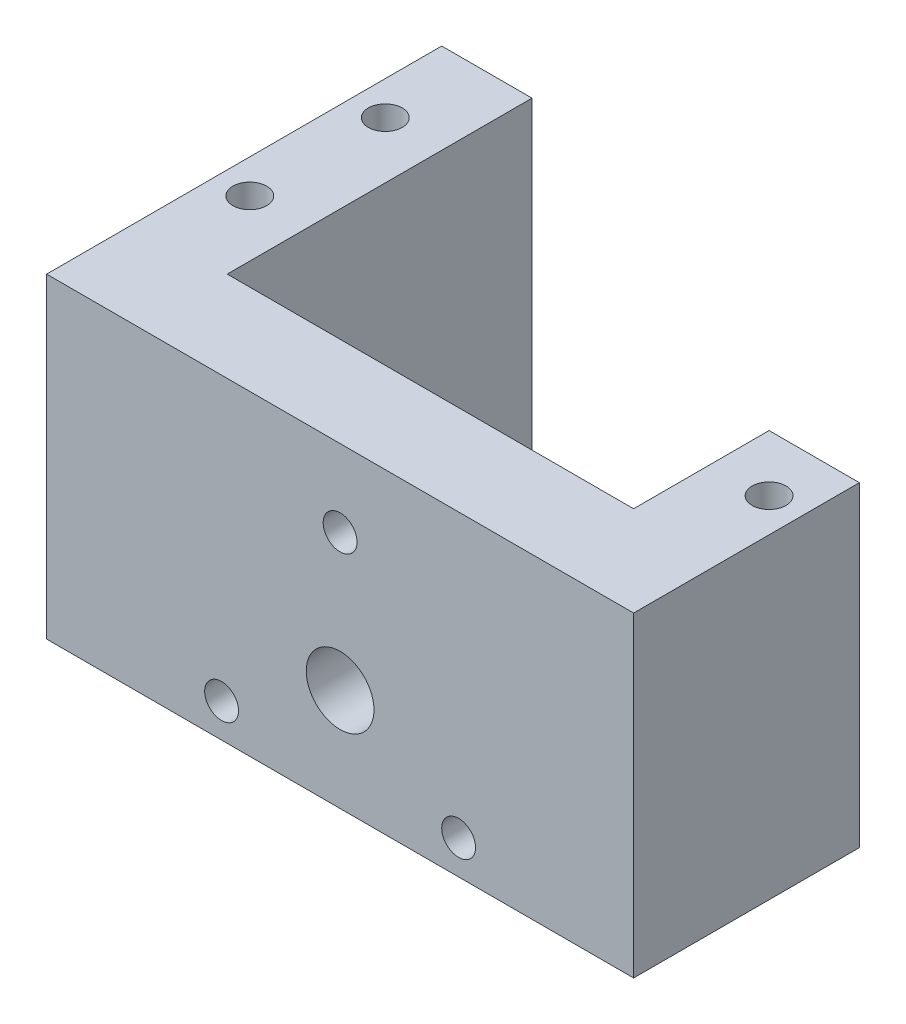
SolidWorks part; units mm, degrees
ref_plane "前视基准面" through (0, 0, 0) normal (0, 0, 1) x (1, 0, 0)
ref_plane "上视基准面" through (0, 0, 0) normal (0, 1, 0) x (1, 0, 0)
ref_plane "右视基准面" through (0, 0, 0) normal (1, 0, 0) x (0, 0, -1)
sketch "草图1" plane through (0, 0, 0) normal (0, 0, 1) x (1, 0, 0)
  line L0 (0, 14) -> (0, -14) construction
  line L1 (-18, 14) -> (18, 14)
  line L2 (-18, 14) -> (-18, -14)
  line L3 (-18, -14) -> (18, -14)
  line L4 (18, 14) -> (18, -14)
  line L5 (-18, 14) -> (18, -14) construction
  line L6 (-18, -14) -> (18, 14) construction
  line L7 (0, 7.1865) -> (-10.5, -11) construction
  line L8 (-10.5, -11) -> (10.5, -11) construction
  line L9 (10.5, -11) -> (0, 7.1865) construction
  line L10 (5.25, -1.9067) -> (-10.5, -11) construction
  circle A0 centre (-10.5, -11) radius 1.5
  circle A1 centre (0, 7.1865) radius 1.5
  circle A2 centre (10.5, -11) radius 1.5
  circle A3 centre (0, -4.9378) radius 8.5
  point P0 (0, 0)
  dimension "D3" = 3
  dimension "D4" = 10.5
  dimension "D5" = 3
  dimension "D6" = 21
  dimension "D7" = 3
  dimension "D8" = 17
  dimension "D1" = 28
  dimension "D2" = 36
extrude "凸台-拉伸1" add sketch "草图1" along normal blind 8
sketch "草图2" plane through (0, 0, 0) normal (0, 0, -1) x (-1, 0, 0)
  circle A0 centre (0, -4.9378) radius 8.5
  circle A1 centre (0, -4.9378) radius 3
  circle A2 centre (0, -4.9378) radius 8.5 construction
  dimension "D1" = 6
extrude "凸台-拉伸2" add sketch "草图2" against normal blind 5
sketch "草图3" plane through (0, 0, 0) normal (0, 0, -1) x (-1, 0, 0)
  line L0 (0, 14) -> (0, -14) construction
  line L1 (-18, 14) -> (18, 14) construction
  line L2 (18, -14) -> (-18, -14) construction
  line L3 (26, 14) -> (26, -14)
  line L4 (-18, 14) -> (-26, 14)
  line L5 (-18, 14) -> (-18, -14)
  line L6 (-18, -14) -> (-26, -14)
  line L7 (-26, 14) -> (-26, -14)
  line L8 (18, -14) -> (26, -14)
  line L9 (18, 14) -> (18, -14)
  line L10 (18, 14) -> (26, 14)
  dimension "D1" = 8
extrude "凸台-拉伸3" add sketch "草图3" against normal blind 35
sketch "草图4" plane through (0, 14, 0) normal (0, 1, 0) x (1, 0, 0)
  line L2 (26, 0) -> (-26, 0) construction
  line L3 (-26, -35) -> (-26, 0) construction
  line L4 (26, -35) -> (26, 0) construction
  circle A0 centre (-23, -15) radius 1.5
  circle A1 centre (-23, -27) radius 1.5
  circle A2 centre (23, -15) radius 1.5
  dimension "D1" = 3
  dimension "D2" = 3
  dimension "D3" = 3
  dimension "D4" = 15
  dimension "D5" = 12
  dimension "D6" = 15
  dimension "D7" = 3
  dimension "D8" = 3
extrude "切除-拉伸1" cut sketch "草图4" against normal blind 30
mirror "镜向1" about plane through (0, 0, 0) normal (0, 0, 1)
sketch "草图5" plane through (0, 14, 0) normal (0, 1, 0) x (1, 0, 0)
  line L0 (-26, 0) -> (26, 0)
  line L1 (-26, -35) -> (-26, 35) construction
  line L2 (26, -35) -> (26, 35) construction
  line L3 (26, 0) -> (26, -35)
  line L4 (18, -35) -> (26, -35) construction
  line L5 (26, -35) -> (-26, -35)
  line L6 (-26, -35) -> (-26, 0)
  line L7 (-26, 0) -> (-26.0289, 0.0779)
extrude "切除-拉伸2" cut sketch "草图5" against normal blind 54 contours L0 M10 M11 M12 M13 M14 M15 M4 M2 M3 M1
sketch "草图7" plane through (0, 14, 0) normal (0, 1, 0) x (1, 0, 0)
  line L0 (18, 35) -> (18, 8) construction
  line L1 (18, 20) -> (26, 20)
  line L2 (18, 20) -> (18, 35)
  line L3 (18, 35) -> (26, 35)
  line L4 (26, 20) -> (26, 35)
  dimension "D1" = 15
extrude "切除-拉伸3" cut sketch "草图7" against normal blind 45
